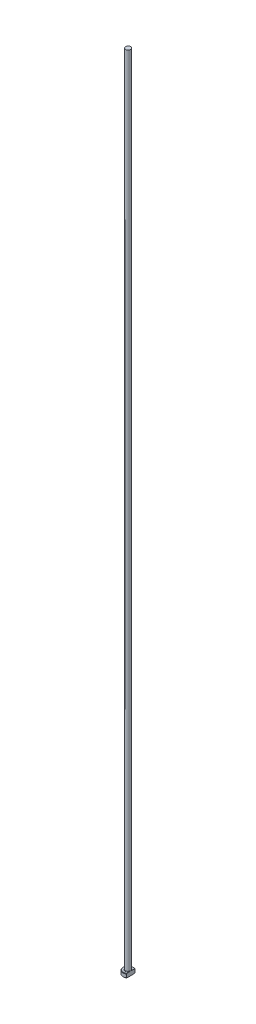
SolidWorks part; units mm, degrees
ref_plane "Front Plane" through (0, 0, 0) normal (0, 0, 1) x (1, 0, 0)
ref_plane "Top Plane" through (0, 0, 0) normal (0, 1, 0) x (1, 0, 0)
ref_plane "Right Plane" through (0, 0, 0) normal (1, 0, 0) x (0, 0, -1)
sketch "Sketch1" plane through (0, 0, 0) normal (0, 0, 1) x (1, 0, 0)
  line L0 (0, 259.9588) -> (0, -15.1925) construction
  line L1 (0, 0) -> (-2.5, 0)
  line L2 (-2.5, 0) -> (-2.5, 2)
  line L3 (-2.5, 2) -> (-1.25, 2)
  line L4 (-1.25, 2) -> (-1.25, 400)
  line L5 (-1.25, 400) -> (0, 400)
  line L6 (0, 400) -> (0, 0)
  dimension "L" = 400
  dimension "H" = 5
  dimension "T" = 2
  dimension "D" = 2.5
revolve "Revolve1" add sketch "Sketch1" angle 360 about L0
chamfer "Chamfer1" distance 0.2 angle 45 2 edges at (0, 2, 2.5) (0, 0, 2.5)
fillet "Fillet1" radius 0.2 1 edges at (0, 2, 1.25)
sketch "Sketch2" plane through (0, 0, 0) normal (0, 1, 0) x (1, 0, 0)
  line L0 (1.25, 2.1651) -> (1.25, -2.1651)
  circle A0 centre (0, 0) radius 2.5 construction
  arc A1 (1.25, -2.1651) -> (1.25, 2.1651) centre (0, 0) ccw
  circle A2 centre (0, 0) radius 1.25 construction
extrude "KEY" cut sketch "Sketch2" along normal through all
